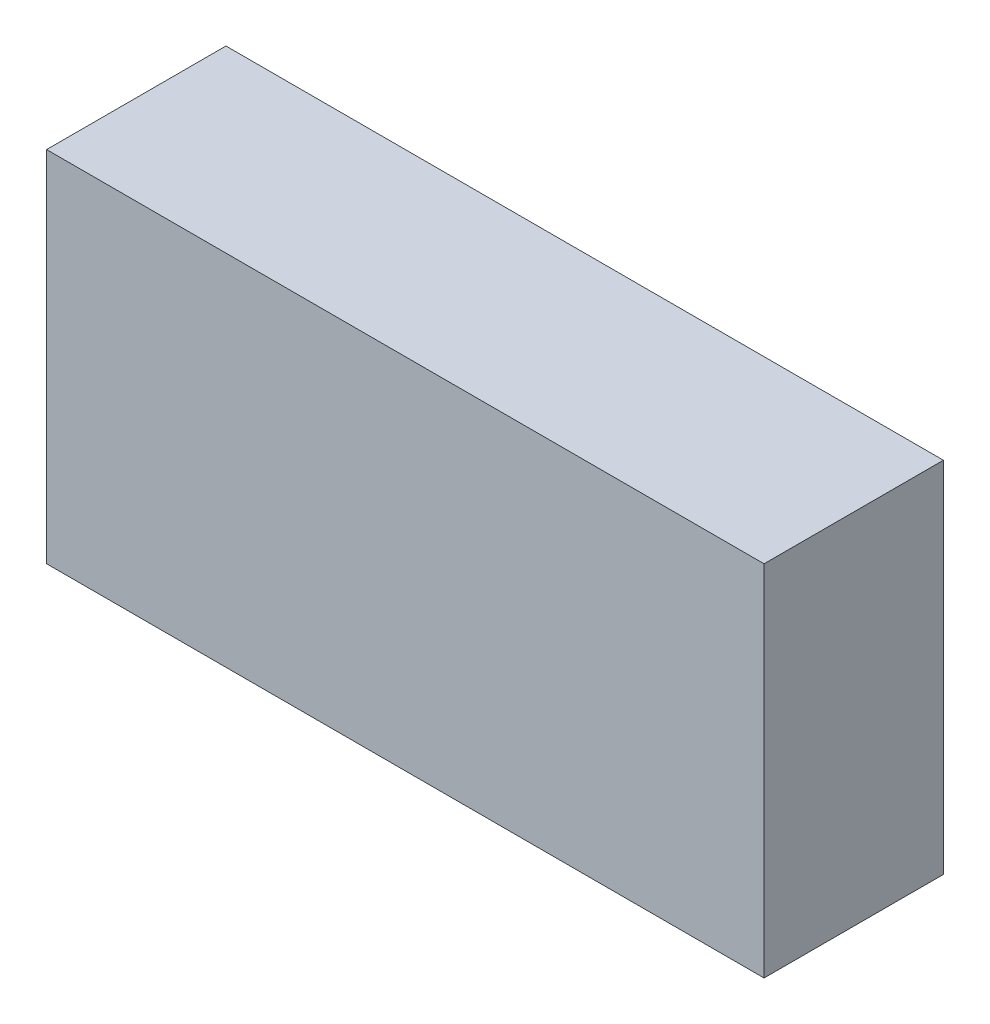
SolidWorks part; units mm, degrees
ref_plane "Front Plane" through (0, 0, 0) normal (0, 0, 1) x (1, 0, 0)
ref_plane "Top Plane" through (0, 0, 0) normal (0, 1, 0) x (1, 0, 0)
ref_plane "Right Plane" through (0, 0, 0) normal (1, 0, 0) x (0, 0, -1)
sketch "Sketch1" plane through (0, 0, 0) normal (0, 0, 1) x (1, 0, 0)
  line L1 (-6.35, -3.175) -> (6.35, -3.175)
  line L2 (-6.35, -3.175) -> (-6.35, 3.175)
  line L3 (-6.35, 3.175) -> (6.35, 3.175)
  line L4 (6.35, -3.175) -> (6.35, 3.175)
  line L5 (-6.35, -3.175) -> (6.35, 3.175) construction
  line L6 (-6.35, 3.175) -> (6.35, -3.175) construction
  point P0 (0, 0)
  dimension "D1" = 12.7
  dimension "D2" = 6.35
extrude "Boss-Extrude1" add sketch "Sketch1" along normal blind 3.175
